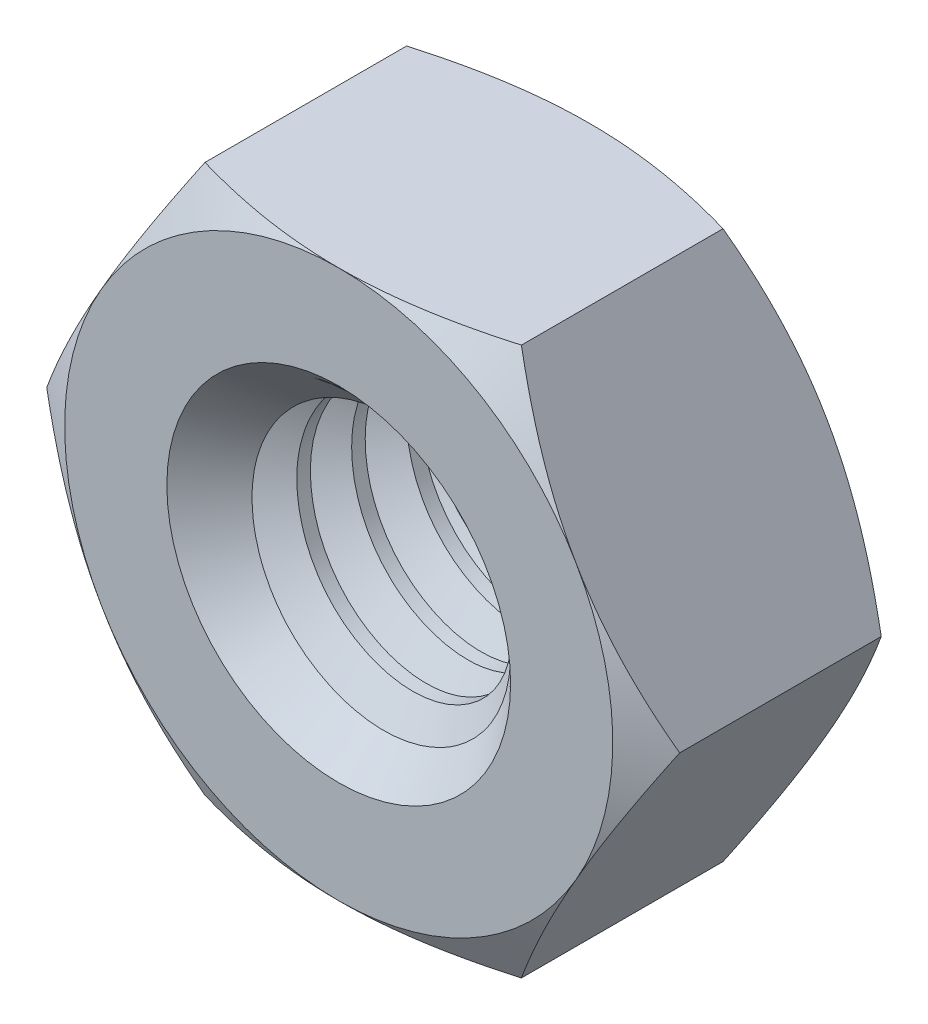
SolidWorks part; units mm, degrees
ref_plane "Front" through (0, 0, 0) normal (0, 0, 1) x (1, 0, 0)
ref_plane "Top" through (0, 0, 0) normal (0, 1, 0) x (1, 0, 0)
ref_plane "Right" through (0, 0, 0) normal (1, 0, 0) x (0, 0, -1)
sketch "Çizim1" plane through (0, 0, 0) normal (0, 0, 1) x (1, 0, 0)
  line L1 (4.0415, 0) -> (2.0207, 3.5)
  line L2 (2.0207, 3.5) -> (-2.0207, 3.5)
  line L3 (-2.0207, 3.5) -> (-4.0415, 0)
  line L4 (-4.0415, 0) -> (-2.0207, -3.5)
  line L5 (-2.0207, -3.5) -> (2.0207, -3.5)
  line L6 (2.0207, -3.5) -> (4.0415, 0)
  circle A0 centre (0, 0) radius 3.5 construction
  point P1 (0, 0)
  dimension "D1" = 7
extrude "Yükseklik-Ekstrüzyon1" add sketch "Çizim1" along normal blind 3.2
sketch "Çizim2" plane through (0, 0, 3.2) normal (0, 0, 1) x (1, 0, 0)
  circle A0 centre (0, 0) radius 3.5
extrude "Kes-Ekstrüzyon1" cut sketch "Çizim2" against normal blind 3.2 draft 60 flip side to cut
sketch "Çizim3" plane through (0, 0, 0) normal (0, 0, -1) x (-1, 0, 0)
  circle A0 centre (0, 0) radius 3.5
extrude "Kes-Ekstrüzyon2" cut sketch "Çizim3" against normal blind 3.2 draft 60 flip side to cut
sketch "Çizim5" plane through (0, 0, 0) normal (0, 0, -1) x (-1, 0, 0)
  circle A0 centre (0, 0) radius 1.545
  dimension "D1" = 3.09
extrude "Kes-Ekstrüzyon3" cut sketch "Çizim5" against normal blind 3.2
chamfer "Pah1" distance 0.65 angle 45 2 edges at (-1.545, 0, 3.2) (-1.545, 0, 0)
sketch "Çizim6" plane through (0, 0, 0) normal (0, 0, -1) x (-1, 0, 0)
  circle A0 centre (0, 0) radius 1.545
curve "Helis/Spiral1"
ref_plane "Düzlem1" through (-0.3438, -1.5063, 4) normal (0.9724, -0.2219, 0.0719) x (0.0701, -0.016, -0.9974)
sketch "Çizim7" plane through (-0.3438, -1.5063, 4) normal (0.9724, -0.2219, 0.0719) x (0.0701, -0.016, -0.9974)
  line L0 (0.3473, 0.1465) -> (-0.3473, 0.1465)
  line L1 (0, -0.455) -> (0.3473, 0.1465)
  line L3 (-0.3473, 0.1465) -> (0, -0.455)
  line L5 (0.394, 0.2275) -> (0, 0.2275)
  circle A0 centre (0, 0) radius 0.2275 construction
  dimension "D1" = 0.455
sweep "Kes-Süpür1" cut profiles "Çizim7" path "Helis/Spiral1"
